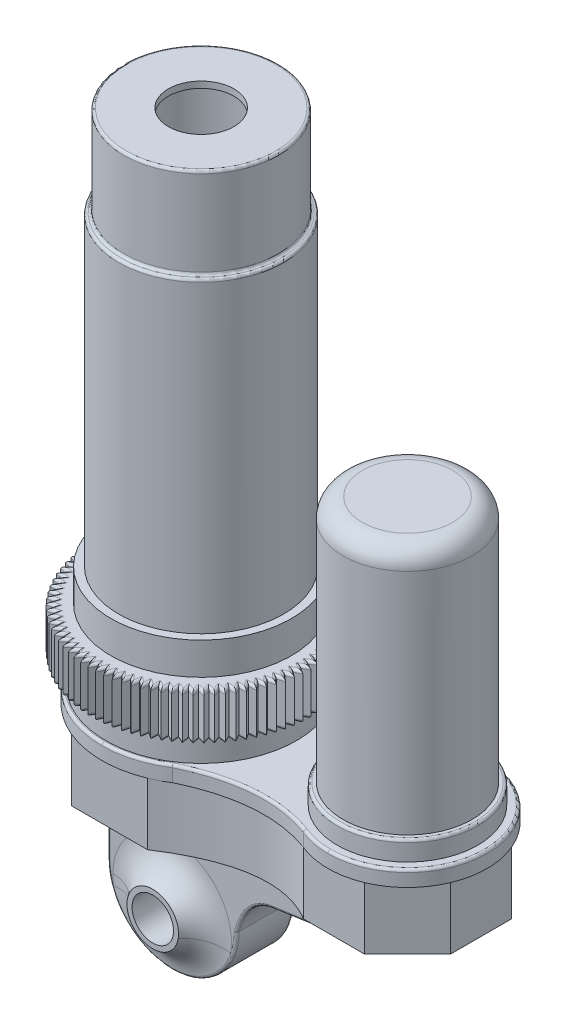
SolidWorks part; units mm, degrees
ref_plane "Front Plane" through (0, 0, 0) normal (0, 0, 1) x (1, 0, 0)
ref_plane "Top Plane" through (0, 0, 0) normal (0, 1, 0) x (1, 0, 0)
ref_plane "Right Plane" through (0, 0, 0) normal (1, 0, 0) x (0, 0, -1)
other "Configuration Table"
imported_body "HITITECH_90mm_shock_absorber_Base.step<1>"
sketch "草图2" plane through (0, -12.0392, 0) normal (0, 1, 0) x (1, 0, 0)
  circle A1 centre (-34.3475, -14.67) radius 4.7
  circle A2 centre (-34.3475, -14.67) radius 4.7
  dimension "D1" = 0
extrude "切除-拉伸1" cut sketch "草图2" against normal blind 4
sketch "草图3" plane through (0, 0, 18.42) normal (0, 0, 1) x (1, 0, 0)
  circle A0 centre (-34.3475, -44.5678) radius 1.61
extrude "切除-拉伸2" cut sketch "草图3" against normal blind 10
fillet "圆角1" radius 3 2 edges at (-36.3475, -44.5678, 16.92) (-36.3475, -44.5678, 12.42)
